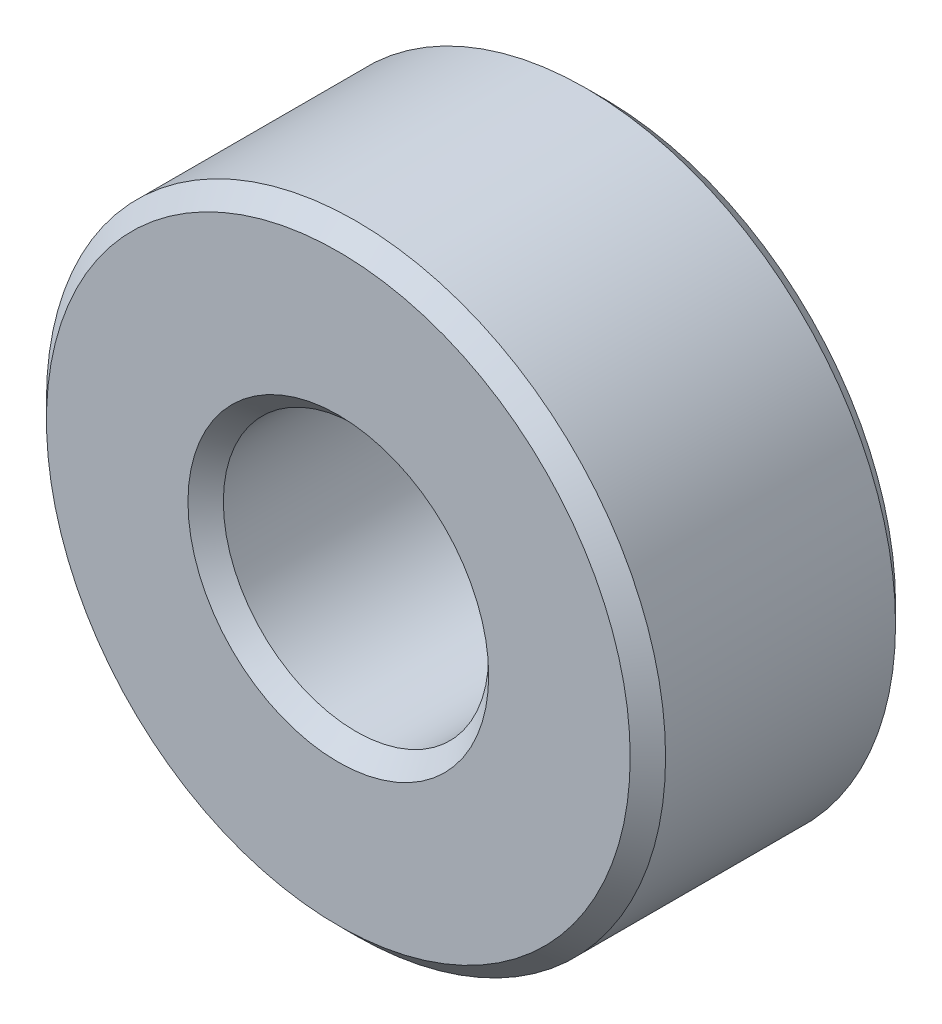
SolidWorks part; units mm, degrees
ref_plane "Face" through (0, 0, 0) normal (0, 0, 1) x (1, 0, 0)
ref_plane "Dessus" through (0, 0, 0) normal (0, 1, 0) x (1, 0, 0)
ref_plane "Droite" through (0, 0, 0) normal (1, 0, 0) x (0, 0, -1)
sketch "Esquisse1" plane through (0, 0, 0) normal (0, 0, 1) x (1, 0, 0)
  circle A0 centre (0, 0) radius 3.5
  circle A1 centre (0, 0) radius 1.5
  dimension "D1" = 7
  dimension "D2" = 3
extrude "Cylindre de base" add sketch "Esquisse1" along normal mid plane 3
chamfer "Chanfrein1" distance 0.2 angle 45
